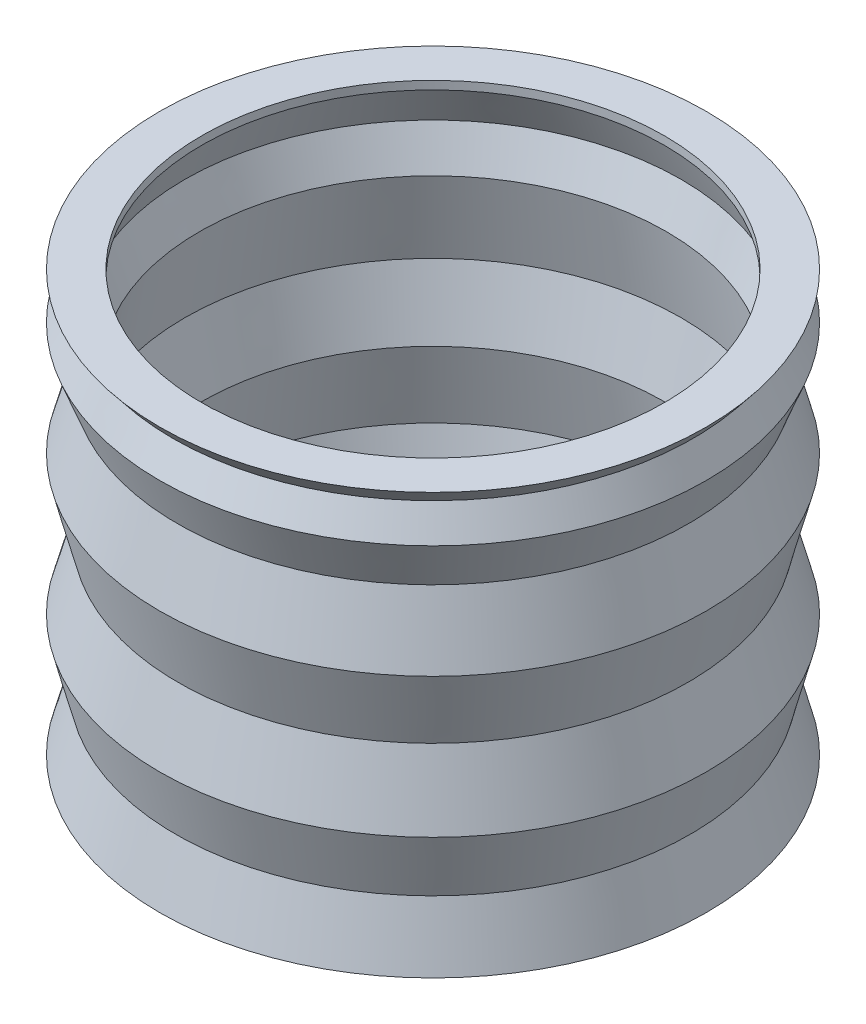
SolidWorks part; units mm, degrees
ref_plane "Plan de face" through (0, 0, 0) normal (0, 0, 1) x (1, 0, 0)
ref_plane "Plan de dessus" through (0, 0, 0) normal (0, 1, 0) x (1, 0, 0)
ref_plane "Plan de droite" through (0, 0, 0) normal (1, 0, 0) x (0, 0, -1)
sketch "Esquisse1" plane through (0, 0, 0) normal (0, 0, 1) x (1, 0, 0)
  line L0 (0, 0) -> (0, 67.8716) construction
  line L1 (-11, 0) -> (-11, 67.8716) construction
  line L2 (-13, 0) -> (-13, 67.8716) construction
  line L3 (-11, 0) -> (-13, 0)
  line L4 (-52.0865, 20) -> (34.1759, 20) construction
  line L5 (-13, 0) -> (-12.2373, 2.8429)
  line L6 (-12.2373, 2.8429) -> (-13, 5.7932)
  line L7 (-13, 5.7932) -> (-12.1272, 9.0464)
  line L8 (-12.1272, 9.0464) -> (-13, 12.4225)
  line L9 (-13, 12.4225) -> (-12.15, 15.5908)
  line L10 (-12.15, 15.5908) -> (-13, 17.7978)
  line L11 (-13, 17.7978) -> (-12.3715, 19.2136)
  line L12 (-12.3715, 19.2136) -> (-13, 20)
  line L13 (-13, 20) -> (-11, 20)
  line L14 (-11, 20) -> (-11, 19.6068)
  line L15 (-11, 19.6068) -> (-11.8031, 17.7978)
  line L16 (-11.8031, 17.7978) -> (-11.1077, 15.9922)
  line L17 (-11.1077, 15.9922) -> (-11.8031, 12.1014)
  line L18 (-11.8031, 12.1014) -> (-11, 9.0464)
  line L19 (-11, 9.0464) -> (-11.6463, 5.43)
  line L20 (-11.6463, 5.43) -> (-11, 2.9712)
  line L21 (-11, 2.9712) -> (-11.4161, 0.6431)
  line L22 (-11.4161, 0.6431) -> (-11, 0.28)
  line L23 (-11, 0.28) -> (-11, 0)
  dimension "D1" = 11
  dimension "D2" = 2
  dimension "D3" = 20
revolve "Révolution1" add sketch "Esquisse1" angle 360 about L0
